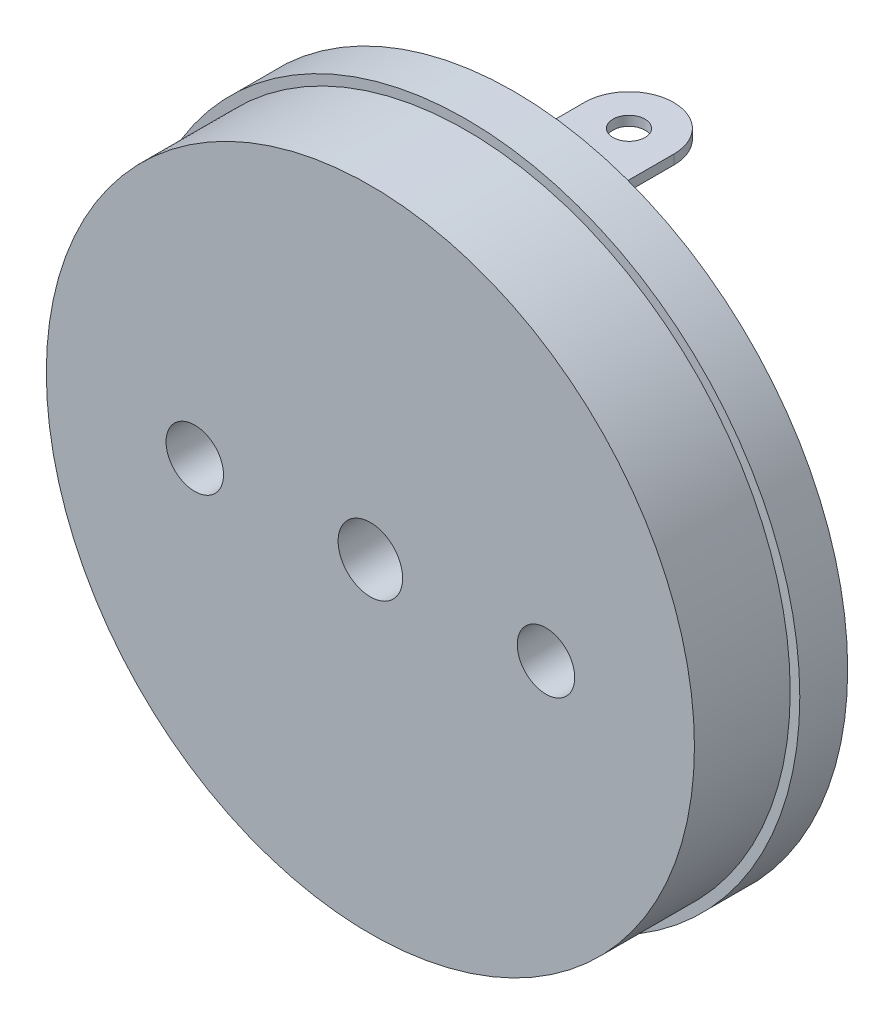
SolidWorks part; units mm, degrees
ref_plane "Face" through (0, 0, 0) normal (0, 0, 1) x (1, 0, 0)
ref_plane "Dessus" through (0, 0, 0) normal (0, 1, 0) x (1, 0, 0)
ref_plane "Droite" through (0, 0, 0) normal (1, 0, 0) x (0, 0, -1)
sketch "Esquisse1" plane through (0, 0, 0) normal (0, 0, 1) x (1, 0, 0)
  circle A0 centre (0, 0) radius 10.45
extrude "Base-Extrusion" add sketch "Esquisse1" along normal blind 1.5
sketch "Esquisse2" plane through (0, 0, 1.5) normal (0, 0, 1) x (1, 0, 0)
  circle A0 centre (0, 0) radius 10.15
extrude "Boss.-Extru.1" add sketch "Esquisse2" along normal blind 3
sketch "Esquisse4"
  line L0 (-12.0736, 0) -> (12.0376, 0) construction
  line L1 (-5.5, 5.1641) -> (-5.5, -4.6243) construction
  line L2 (5.5, 5.1641) -> (5.5, -4.6243) construction
  line L3 (0, 5.7399) -> (0, -6.8555) construction
  circle A0 centre (-5.5, 0) radius 0.9
  circle A1 centre (5.5, 0) radius 0.9
extrude "Enlèv. mat.-Extru.1" cut sketch "Esquisse3" against normal through all
sketch "Esquisse3" plane through (0, 0, 4.5) normal (0, 0, 1) x (1, 0, 0)
  circle A0 centre (0, 0) radius 1.01
extrude "Enlèv. mat.-Extru.2" cut sketch "Esquisse4" against normal through all
sketch "Esquisse6" plane through (0, 0, 0) normal (0, 0, -1) x (-1, 0, 0)
  line L0 (2.328, 2.0166) -> (2.328, -2.0166)
  arc A0 (2.328, 2.0166) -> (2.328, -2.0166) centre (0, 0) ccw
extrude "Boss.-Extru.3" add sketch "Esquisse6" along normal blind 2
sketch "Esquisse7" plane through (0, 0, 0) normal (0, 0, -1) x (-1, 0, 0)
  line L0 (0, 12.1456) -> (0, -13.4051) construction
  line L1 (-2.609, 7.5) -> (3.5807, 7.5) construction
  line L2 (-8.0431, 0) -> (8.3669, 0) construction
  line L3 (-1.4, 8.9067) -> (-1.4, 6.0638) construction
  line L4 (1.4, 8.9067) -> (1.4, 6.0638) construction
  line L5 (1.4, 7.65) -> (1.4, 7.35)
  line L6 (-1.4, 7.65) -> (1.4, 7.65)
  line L7 (-1.4, 7.35) -> (1.4, 7.35)
  line L8 (-1.4, 7.65) -> (-1.4, 7.35)
  line L9 (-1.4, -7.65) -> (-1.4, -7.35)
  line L10 (-1.4, -7.35) -> (1.4, -7.35)
  line L11 (-1.4, -7.65) -> (1.4, -7.65)
  line L12 (1.4, -7.65) -> (1.4, -7.35)
extrude "Boss.-Extru.4" add sketch "Esquisse7" along normal blind 5
fillet "Congé1" radius 1.39 4 edges at (-1.4, -7.5, -5) (1.4, -7.5, -5) (1.4, 7.5, -5) (-1.4, 7.5, -5)
sketch "Esquisse8" plane through (0, 7.65, 0) normal (0, 1, 0) x (-1, 0, 0)
  line L0 (0, 0.762) -> (0, -6.0163) construction
  line L1 (-2.1389, -3.6) -> (2.329, -3.6) construction
  circle A0 centre (0, -3.6) radius 0.5
extrude "Enlèv. mat.-Extru.3" cut sketch "Esquisse8" against normal through all
sketch "Esquisse9" plane through (0, 0, 0) normal (0, 0, -1) x (-1, 0, 0)
  line L1 (-2.8164, -7.9192) -> (-4.9356, -7.9192)
  line L2 (-2.8164, -7.9192) -> (-2.8164, -5.6606)
  line L3 (-2.8164, -5.6606) -> (-4.9356, -5.6606)
  line L4 (-4.9356, -7.9192) -> (-4.9356, -5.6606)
  circle A0 centre (3.625, 7.0827) radius 1.1292
extrude "Enlèv. mat.-Extru.4" cut sketch "Esquisse9" against normal blind 1
